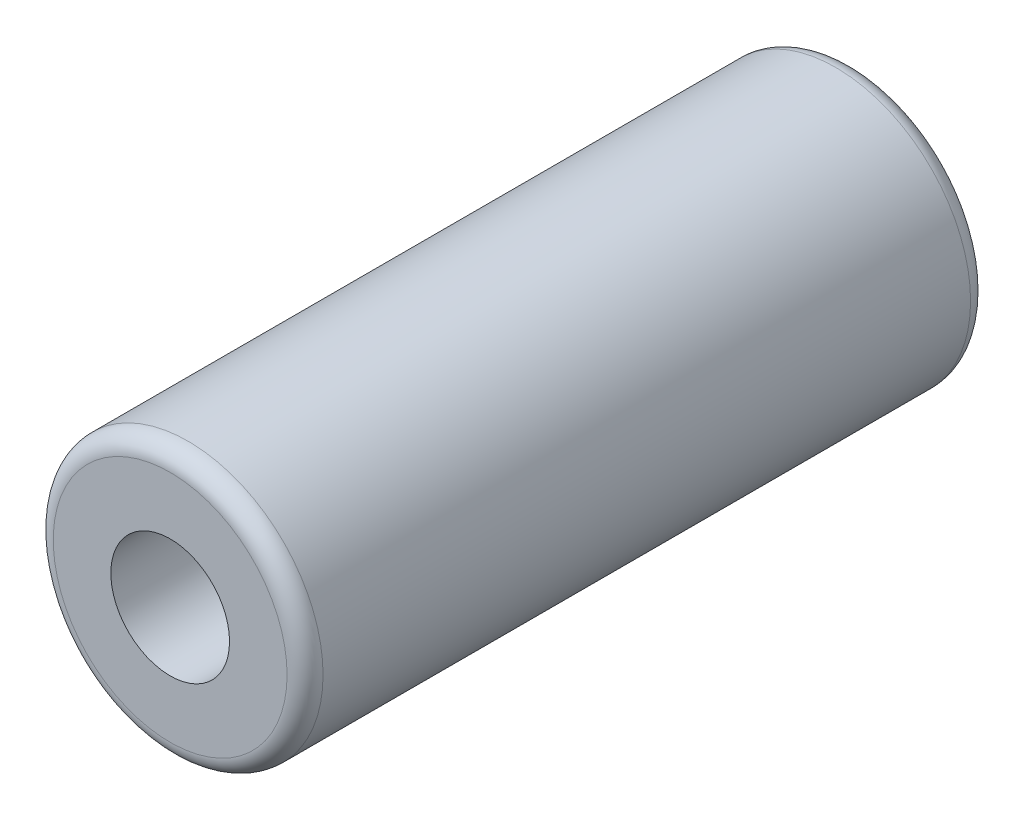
SolidWorks part; units mm, degrees
ref_plane "Plan de face" through (0, 0, 0) normal (0, 0, 1) x (1, 0, 0)
ref_plane "Plan de dessus" through (0, 0, 0) normal (0, 1, 0) x (1, 0, 0)
ref_plane "Plan de droite" through (0, 0, 0) normal (1, 0, 0) x (0, 0, -1)
sketch "Esquisse1" plane through (0, 0, 0) normal (0, 0, 1) x (1, 0, 0)
  circle A0 centre (0, 0) radius 37.5
  dimension "D1" = 75
extrude "Extrusion1" add sketch "Esquisse1" along normal blind 190
sketch "Esquisse2" plane through (0, 0, 190) normal (0, 0, 1) x (1, 0, 0)
  circle A0 centre (0, 0) radius 16.5
  dimension "D1" = 33
extrude "Enlèv. mat.-Extru.1" cut sketch "Esquisse2" against normal up to next
fillet "Congé1" radius 5 2 edges at (37.5, 0, 0) (37.5, 0, 190)
